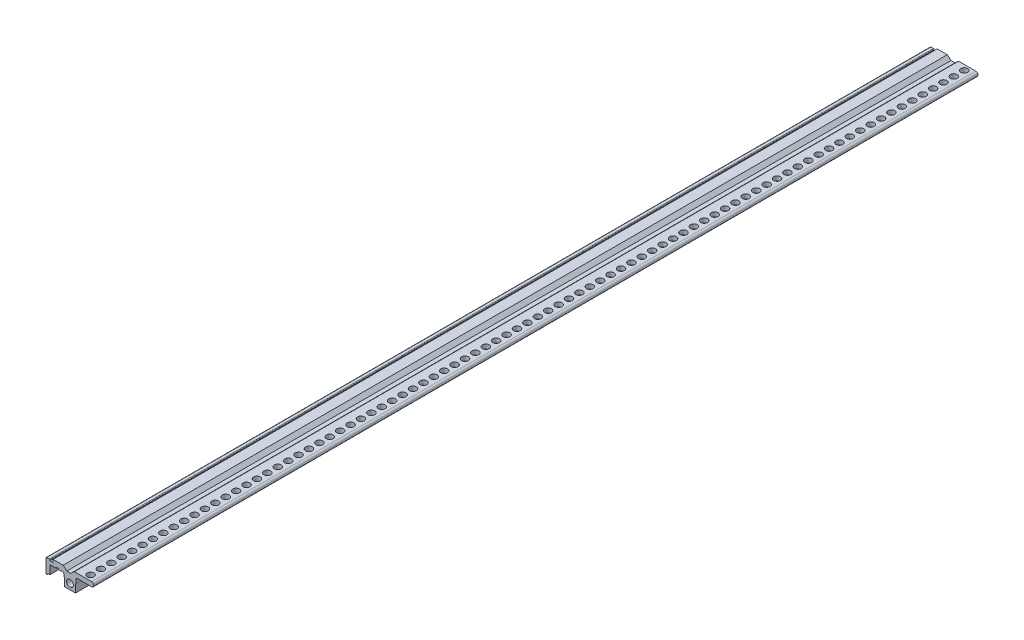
SolidWorks part; units mm, degrees
ref_plane "前视基准面" through (0, 0, 0) normal (0, 0, 1) x (1, 0, 0)
ref_plane "上视基准面" through (0, 0, 0) normal (0, 1, 0) x (1, 0, 0)
ref_plane "右视基准面" through (0, 0, 0) normal (1, 0, 0) x (0, 0, -1)
sketch "草图1" plane through (0, 0, 0) normal (0, 0, 1) x (1, 0, 0)
  line L2 (2426.9819, -3175.6208) -> (2418.5819, -3175.6208)
  line L3 (2418.5819, -3175.6208) -> (2416.8319, -3177.2208)
  line L4 (2416.8319, -3177.2208) -> (2414.8819, -3177.2208)
  line L5 (2414.8819, -3177.2208) -> (2413.1319, -3175.6208)
  line L6 (2413.1319, -3175.6208) -> (2408.1819, -3175.6208)
  line L7 (2408.1819, -3175.6208) -> (2408.1819, -3176.9708)
  line L8 (2408.1819, -3176.9708) -> (2406.6819, -3176.9708)
  line L9 (2406.6819, -3176.9708) -> (2406.6819, -3176.6708)
  line L10 (2406.3819, -3176.3708) -> (2405.1319, -3176.3708)
  line L11 (2404.7319, -3176.7708) -> (2404.7319, -3183.1708)
  line L12 (2405.0319, -3183.4708) -> (2405.2319, -3183.4708)
  line L13 (2406.2711, -3182.8708) -> (2406.6819, -3182.8708)
  line L14 (2406.6819, -3182.8708) -> (2406.6819, -3179.1208)
  line L15 (2407.1819, -3178.6208) -> (2409.8319, -3178.6208)
  line L16 (2410.8319, -3178.6208) -> (2412.9319, -3178.6208)
  line L17 (2413.4319, -3179.1208) -> (2413.4319, -3180.4208)
  line L18 (2413.4319, -3180.4208) -> (2413.7319, -3180.4208)
  line L19 (2413.7319, -3180.4208) -> (2413.7319, -3184.4208)
  line L20 (2413.7319, -3184.4208) -> (2419.1319, -3184.4208)
  line L21 (2419.1319, -3184.4208) -> (2419.1319, -3180.4208)
  line L22 (2419.1319, -3180.4208) -> (2419.4319, -3180.4208)
  line L23 (2419.4319, -3180.4208) -> (2419.4319, -3178.3208)
  line L24 (2419.9319, -3177.8208) -> (2426.9819, -3177.8208)
  circle A0 centre (2416.4319, -3181.5808) radius 1.5
  arc A1 (2406.6819, -3176.6708) -> (2406.3819, -3176.3708) centre (2406.3819, -3176.6708) ccw
  arc A2 (2405.1319, -3176.3708) -> (2404.7319, -3176.7708) centre (2405.1319, -3176.7708) ccw
  arc A3 (2404.7319, -3183.1708) -> (2405.0319, -3183.4708) centre (2405.0319, -3183.1708) ccw
  arc A4 (2405.2319, -3183.4708) -> (2405.4917, -3183.3208) centre (2405.2319, -3183.1708) ccw
  arc A5 (2406.2711, -3182.8708) -> (2405.4917, -3183.3208) centre (2406.2711, -3183.7708) ccw
  arc A6 (2407.1819, -3178.6208) -> (2406.6819, -3179.1208) centre (2407.1819, -3179.1208) ccw
  arc A7 (2410.8319, -3178.6208) -> (2409.8319, -3178.6208) centre (2410.3319, -3178.6208) ccw
  arc A8 (2413.4319, -3179.1208) -> (2412.9319, -3178.6208) centre (2412.9319, -3179.1208) ccw
  arc A9 (2419.9319, -3177.8208) -> (2419.4319, -3178.3208) centre (2419.9319, -3178.3208) ccw
  arc A10 (2426.9819, -3177.8208) -> (2426.9819, -3175.6208) centre (2426.9819, -3176.7208) ccw
  dimension "D1" = 3
extrude "凸台-拉伸1" add sketch "草图1" along normal mid plane 431.8
hole_wizard "M4 螺纹孔1" positions "3D草图1" profile "草图2" tap size "M4" standard "Gb"
sketch3d "3D草图1"
  line L0 (2416.4319, -3181.5808, 215.9) -> (2416.4319, -3181.5808, -215.9) construction
  point P0 (2416.4319, -3181.5808, 215.9)
  point P4 (2416.4319, -3181.5808, -215.9)
sketch "草图2" plane through (2416.4319, -3181.5808, 215.9) normal (1, 0, 0) x (0, -1, 0)
  line L0 (0, 0) -> (0, 15.9914)
  line L1 (0, 15.9914) -> (1.65, 15)
  line L2 (1.65, 15) -> (1.65, 0)
  line L5 (1.65, 0) -> (0, 0)
  line L10 (0, 15.9914) -> (-1.65, 15) construction
  line L11 (0, -6.35) -> (0, 107.95) construction
  dimension "螺纹孔钻头直径" = 3.3
  dimension "螺纹孔钻头深度" = 15
  dimension "导头角度" = 118
sketch "草图3" plane through (0, -3175.6208, 0) normal (0, 1, 0) x (1, 0, 0)
  line L0 (2426.9819, -215.9) -> (2418.5819, -215.9) construction
  line L1 (2428.0819, -215.9) -> (2428.0819, 215.9) construction
  circle A0 centre (2423.9319, -213.36) radius 1.65
  circle A1 centre (2423.9319, -208.28) radius 1.65
  circle A2 centre (2423.9319, -203.2) radius 1.65
  circle A3 centre (2423.9319, -198.12) radius 1.65
  circle A4 centre (2423.9319, -193.04) radius 1.65
  circle A5 centre (2423.9319, -187.96) radius 1.65
  circle A6 centre (2423.9319, -182.88) radius 1.65
  circle A7 centre (2423.9319, -177.8) radius 1.65
  circle A8 centre (2423.9319, -172.72) radius 1.65
  circle A9 centre (2423.9319, -167.64) radius 1.65
  circle A10 centre (2423.9319, -162.56) radius 1.65
  circle A11 centre (2423.9319, -157.48) radius 1.65
  circle A12 centre (2423.9319, -152.4) radius 1.65
  circle A13 centre (2423.9319, -147.32) radius 1.65
  circle A14 centre (2423.9319, -142.24) radius 1.65
  circle A15 centre (2423.9319, -137.16) radius 1.65
  circle A16 centre (2423.9319, -132.08) radius 1.65
  circle A17 centre (2423.9319, -127) radius 1.65
  circle A18 centre (2423.9319, -121.92) radius 1.65
  circle A19 centre (2423.9319, -116.84) radius 1.65
  circle A20 centre (2423.9319, -111.76) radius 1.65
  circle A21 centre (2423.9319, -106.68) radius 1.65
  circle A22 centre (2423.9319, -101.6) radius 1.65
  circle A23 centre (2423.9319, -96.52) radius 1.65
  circle A24 centre (2423.9319, -91.44) radius 1.65
  circle A25 centre (2423.9319, -86.36) radius 1.65
  circle A26 centre (2423.9319, -81.28) radius 1.65
  circle A27 centre (2423.9319, -76.2) radius 1.65
  circle A28 centre (2423.9319, -71.12) radius 1.65
  circle A29 centre (2423.9319, -66.04) radius 1.65
  circle A30 centre (2423.9319, -60.96) radius 1.65
  circle A31 centre (2423.9319, -55.88) radius 1.65
  circle A32 centre (2423.9319, -50.8) radius 1.65
  circle A33 centre (2423.9319, -45.72) radius 1.65
  circle A34 centre (2423.9319, -40.64) radius 1.65
  circle A35 centre (2423.9319, -35.56) radius 1.65
  circle A36 centre (2423.9319, -30.48) radius 1.65
  circle A37 centre (2423.9319, -25.4) radius 1.65
  circle A38 centre (2423.9319, -20.32) radius 1.65
  circle A39 centre (2423.9319, -15.24) radius 1.65
  circle A40 centre (2423.9319, -10.16) radius 1.65
  circle A41 centre (2423.9319, -5.08) radius 1.65
  circle A42 centre (2423.9319, 0) radius 1.65
  circle A43 centre (2423.9319, 5.08) radius 1.65
  circle A44 centre (2423.9319, 10.16) radius 1.65
  circle A45 centre (2423.9319, 15.24) radius 1.65
  circle A46 centre (2423.9319, 20.32) radius 1.65
  circle A47 centre (2423.9319, 25.4) radius 1.65
  circle A48 centre (2423.9319, 30.48) radius 1.65
  circle A49 centre (2423.9319, 35.56) radius 1.65
  circle A50 centre (2423.9319, 40.64) radius 1.65
  circle A51 centre (2423.9319, 45.72) radius 1.65
  circle A52 centre (2423.9319, 50.8) radius 1.65
  circle A53 centre (2423.9319, 55.88) radius 1.65
  circle A54 centre (2423.9319, 60.96) radius 1.65
  circle A55 centre (2423.9319, 66.04) radius 1.65
  circle A56 centre (2423.9319, 71.12) radius 1.65
  circle A57 centre (2423.9319, 76.2) radius 1.65
  circle A58 centre (2423.9319, 81.28) radius 1.65
  circle A59 centre (2423.9319, 86.36) radius 1.65
  circle A60 centre (2423.9319, 91.44) radius 1.65
  circle A61 centre (2423.9319, 96.52) radius 1.65
  circle A62 centre (2423.9319, 101.6) radius 1.65
  circle A63 centre (2423.9319, 106.68) radius 1.65
  circle A64 centre (2423.9319, 111.76) radius 1.65
  circle A65 centre (2423.9319, 116.84) radius 1.65
  circle A66 centre (2423.9319, 121.92) radius 1.65
  circle A67 centre (2423.9319, 127) radius 1.65
  circle A68 centre (2423.9319, 132.08) radius 1.65
  circle A69 centre (2423.9319, 137.16) radius 1.65
  circle A70 centre (2423.9319, 142.24) radius 1.65
  circle A71 centre (2423.9319, 147.32) radius 1.65
  circle A72 centre (2423.9319, 152.4) radius 1.65
  circle A73 centre (2423.9319, 157.48) radius 1.65
  circle A74 centre (2423.9319, 162.56) radius 1.65
  circle A75 centre (2423.9319, 167.64) radius 1.65
  circle A76 centre (2423.9319, 172.72) radius 1.65
  circle A77 centre (2423.9319, 177.8) radius 1.65
  circle A78 centre (2423.9319, 182.88) radius 1.65
  circle A79 centre (2423.9319, 187.96) radius 1.65
  circle A80 centre (2423.9319, 193.04) radius 1.65
  circle A81 centre (2423.9319, 198.12) radius 1.65
  circle A82 centre (2423.9319, 203.2) radius 1.65
  circle A83 centre (2423.9319, 208.28) radius 1.65
  circle A84 centre (2423.9319, 213.36) radius 1.65
  dimension "D1" = 3.3
  dimension "D2" = 2.54
  dimension "D3" = 4.15
  dimension "D4" = 85
extrude "切除-拉伸1" cut sketch "草图3" against normal blind 431.8
sketch "草图4" plane through (2404.7319, 0, 0) normal (-1, 0, 0) x (0, 0, 1)
  line L0 (-215.9, -3176.7708) -> (-215.9, -3183.1708) construction
  line L1 (215.9, -3175.6208) -> (-215.9, -3175.6208) construction
  circle A0 centre (-210.82, -3180.8708) radius 1
  circle A1 centre (-205.74, -3180.8708) radius 1
  circle A2 centre (-200.66, -3180.8708) radius 1
  circle A3 centre (-195.58, -3180.8708) radius 1
  circle A4 centre (-190.5, -3180.8708) radius 1
  circle A5 centre (-185.42, -3180.8708) radius 1
  circle A6 centre (-180.34, -3180.8708) radius 1
  circle A7 centre (-175.26, -3180.8708) radius 1
  circle A8 centre (-170.18, -3180.8708) radius 1
  circle A9 centre (-165.1, -3180.8708) radius 1
  circle A10 centre (-160.02, -3180.8708) radius 1
  circle A11 centre (-154.94, -3180.8708) radius 1
  circle A12 centre (-149.86, -3180.8708) radius 1
  circle A13 centre (-144.78, -3180.8708) radius 1
  circle A14 centre (-139.7, -3180.8708) radius 1
  circle A15 centre (-134.62, -3180.8708) radius 1
  circle A16 centre (-129.54, -3180.8708) radius 1
  circle A17 centre (-124.46, -3180.8708) radius 1
  circle A18 centre (-119.38, -3180.8708) radius 1
  circle A19 centre (-114.3, -3180.8708) radius 1
  circle A20 centre (-109.22, -3180.8708) radius 1
  circle A21 centre (-104.14, -3180.8708) radius 1
  circle A22 centre (-99.06, -3180.8708) radius 1
  circle A23 centre (-93.98, -3180.8708) radius 1
  circle A24 centre (-88.9, -3180.8708) radius 1
  circle A25 centre (-83.82, -3180.8708) radius 1
  circle A26 centre (-78.74, -3180.8708) radius 1
  circle A27 centre (-73.66, -3180.8708) radius 1
  circle A28 centre (-68.58, -3180.8708) radius 1
  circle A29 centre (-63.5, -3180.8708) radius 1
  circle A30 centre (-58.42, -3180.8708) radius 1
  circle A31 centre (-53.34, -3180.8708) radius 1
  circle A32 centre (-48.26, -3180.8708) radius 1
  circle A33 centre (-43.18, -3180.8708) radius 1
  circle A34 centre (-38.1, -3180.8708) radius 1
  circle A35 centre (-33.02, -3180.8708) radius 1
  circle A36 centre (-27.94, -3180.8708) radius 1
  circle A37 centre (-22.86, -3180.8708) radius 1
  circle A38 centre (-17.78, -3180.8708) radius 1
  circle A39 centre (-12.7, -3180.8708) radius 1
  circle A40 centre (-7.62, -3180.8708) radius 1
  circle A41 centre (-2.54, -3180.8708) radius 1
  circle A42 centre (2.54, -3180.8708) radius 1
  circle A43 centre (7.62, -3180.8708) radius 1
  circle A44 centre (12.7, -3180.8708) radius 1
  circle A45 centre (17.78, -3180.8708) radius 1
  circle A46 centre (22.86, -3180.8708) radius 1
  circle A47 centre (27.94, -3180.8708) radius 1
  circle A48 centre (33.02, -3180.8708) radius 1
  circle A49 centre (38.1, -3180.8708) radius 1
  circle A50 centre (43.18, -3180.8708) radius 1
  circle A51 centre (48.26, -3180.8708) radius 1
  circle A52 centre (53.34, -3180.8708) radius 1
  circle A53 centre (58.42, -3180.8708) radius 1
  circle A54 centre (63.5, -3180.8708) radius 1
  circle A55 centre (68.58, -3180.8708) radius 1
  circle A56 centre (73.66, -3180.8708) radius 1
  circle A57 centre (78.74, -3180.8708) radius 1
  circle A58 centre (83.82, -3180.8708) radius 1
  circle A59 centre (88.9, -3180.8708) radius 1
  circle A60 centre (93.98, -3180.8708) radius 1
  circle A61 centre (99.06, -3180.8708) radius 1
  circle A62 centre (104.14, -3180.8708) radius 1
  circle A63 centre (109.22, -3180.8708) radius 1
  circle A64 centre (114.3, -3180.8708) radius 1
  circle A65 centre (119.38, -3180.8708) radius 1
  circle A66 centre (124.46, -3180.8708) radius 1
  circle A67 centre (129.54, -3180.8708) radius 1
  circle A68 centre (134.62, -3180.8708) radius 1
  circle A69 centre (139.7, -3180.8708) radius 1
  circle A70 centre (144.78, -3180.8708) radius 1
  circle A71 centre (149.86, -3180.8708) radius 1
  circle A72 centre (154.94, -3180.8708) radius 1
  circle A73 centre (160.02, -3180.8708) radius 1
  circle A74 centre (165.1, -3180.8708) radius 1
  circle A75 centre (170.18, -3180.8708) radius 1
  circle A76 centre (175.26, -3180.8708) radius 1
  circle A77 centre (180.34, -3180.8708) radius 1
  circle A78 centre (185.42, -3180.8708) radius 1
  circle A79 centre (190.5, -3180.8708) radius 1
  circle A80 centre (195.58, -3180.8708) radius 1
  circle A81 centre (200.66, -3180.8708) radius 1
  circle A82 centre (205.74, -3180.8708) radius 1
  circle A83 centre (210.82, -3180.8708) radius 1
  dimension "D1" = 2
  dimension "D2" = 5.08
  dimension "D3" = 5.25
  dimension "D4" = 84
extrude "切除-拉伸2" cut sketch "草图4" against normal blind 3
hole_wizard "M2.5 螺纹孔1" positions "3D草图2" profile "草图5" tap size "M2.5" standard "Gb"
sketch3d "3D草图2"
  line L0 (2406.6819, -3180.8708, -210.82) -> (2404.7319, -3180.8708, -210.82) construction
  line L1 (2404.7319, -3183.1708, -215.9) -> (2404.7319, -3183.1708, 215.9) construction
  point P0 (2404.7319, -3180.8708, -210.82)
  dimension "D1" = 431.8
sketch "草图5" plane through (2404.7319, -3180.8708, -210.82) normal (0, 1, 0) x (0, 0, 1)
  line L0 (0, 0) -> (0, 6.9659)
  line L1 (0, 6.9659) -> (1.025, 6.35)
  line L2 (1.025, 6.35) -> (1.025, 0)
  line L5 (1.025, 0) -> (0, 0)
  line L10 (0, 6.9659) -> (-1.025, 6.35) construction
  line L11 (0, -6.35) -> (0, 107.95) construction
  dimension "螺纹孔钻头直径" = 2.05
  dimension "螺纹孔钻头深度" = 6.35
  dimension "导头角度" = 118
pattern_linear "阵列(线性)1" count 84 spacing 5.08 along (0, 0, 1) of "M2.5 螺纹孔1"
equation "\"D4@草图3\"=\"D1@凸台-拉伸1\"/5.08"
equation "\"D4@草图4\"=\"D1@凸台-拉伸1\"/5.08-1"
